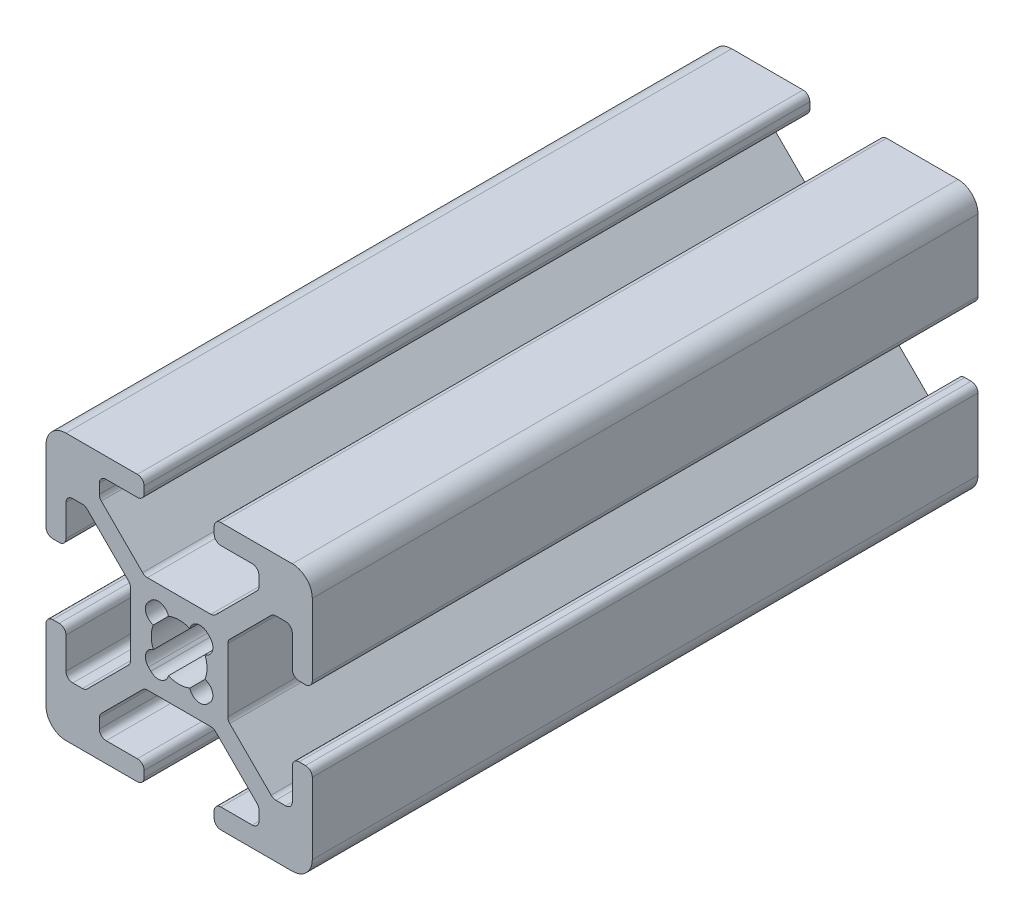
SolidWorks part; units mm, degrees
ref_plane "Front Plane" through (0, 0, 0) normal (0, 0, 1) x (1, 0, 0)
ref_plane "Top Plane" through (0, 0, 0) normal (0, 1, 0) x (1, 0, 0)
ref_plane "Right Plane" through (0, 0, 0) normal (1, 0, 0) x (0, 0, -1)
sketch "Sketch1" plane through (0, 0, 0) normal (0, 0, 1) x (1, 0, 0)
  line L0 (-5.0323, -0.3411) -> (-5.5163, -0.3411)
  line L1 (-6.0243, 0.1669) -> (-6.0243, 2.5159)
  line L2 (-4.5243, 0.1669) -> (-4.5243, 5.5289)
  line L3 (-10.8693, -5.355) -> (-10.8693, -0.5871)
  line L4 (-7.2582, 3.0239) -> (-6.5323, 3.0239)
  line L5 (-7.6174, 2.8752) -> (-10.7205, -0.2279)
  line L6 (-5.0323, -5.6011) -> (-5.5163, -5.6011)
  line L7 (-4.5243, -6.1091) -> (-4.5243, -11.4711)
  line L8 (-6.0243, -6.1091) -> (-6.0243, -8.4581)
  line L9 (-7.2582, -8.9661) -> (-6.5323, -8.9661)
  line L10 (-7.6174, -8.8173) -> (-10.7205, -5.7142)
  line L11 (-12.3994, -5.2756) -> (-12.2198, -5.096)
  line L12 (-17.1543, 6.5209) -> (-17.1543, 6.0369)
  line L13 (-17.6623, 7.0289) -> (-23.0243, 7.0289)
  line L14 (-17.6623, 5.5289) -> (-20.0113, 5.5289)
  line L15 (-12.1404, 0.6839) -> (-16.9082, 0.6839)
  line L16 (-20.5193, 4.295) -> (-20.5193, 5.0209)
  line L17 (-20.3705, 3.9358) -> (-17.2674, 0.8327)
  line L18 (-11.8943, 6.5209) -> (-11.8943, 6.0369)
  line L19 (-11.3863, 7.0289) -> (-6.0243, 7.0289)
  line L20 (-11.3863, 5.5289) -> (-9.0373, 5.5289)
  line L21 (-8.5293, 4.295) -> (-8.5293, 5.0209)
  line L22 (-8.6781, 3.9358) -> (-11.7812, 0.8327)
  line L23 (-12.2198, -0.8462) -> (-12.3994, -0.6666)
  line L24 (-24.0163, -5.6011) -> (-23.5323, -5.6011)
  line L25 (-24.5243, -6.1091) -> (-24.5243, -11.4711)
  line L26 (-23.0243, -6.1091) -> (-23.0243, -8.4581)
  line L27 (-18.1793, -0.5871) -> (-18.1793, -5.355)
  line L28 (-21.7904, -8.9661) -> (-22.5163, -8.9661)
  line L29 (-21.4312, -8.8173) -> (-18.3281, -5.7142)
  line L30 (-24.0163, -0.3411) -> (-23.5323, -0.3411)
  line L31 (-24.5243, 0.1669) -> (-24.5243, 5.5289)
  line L32 (-23.0243, 0.1669) -> (-23.0243, 2.5159)
  line L33 (-21.7904, 3.0239) -> (-22.5163, 3.0239)
  line L34 (-21.4312, 2.8752) -> (-18.3281, -0.2279)
  line L35 (-16.6492, -0.6666) -> (-16.8288, -0.8462)
  line L36 (-11.8943, -12.4631) -> (-11.8943, -11.9791)
  line L37 (-11.3863, -12.9711) -> (-6.0243, -12.9711)
  line L38 (-11.3863, -11.4711) -> (-9.0373, -11.4711)
  line L39 (-16.9082, -6.6261) -> (-12.1404, -6.6261)
  line L40 (-8.5293, -10.2371) -> (-8.5293, -10.9631)
  line L41 (-8.6781, -9.8779) -> (-11.7812, -6.7748)
  line L42 (-17.1543, -12.4631) -> (-17.1543, -11.9791)
  line L43 (-17.6623, -12.9711) -> (-23.0243, -12.9711)
  line L44 (-17.6623, -11.4711) -> (-20.0113, -11.4711)
  line L45 (-20.5193, -10.2371) -> (-20.5193, -10.9631)
  line L46 (-20.3705, -9.8779) -> (-17.2674, -6.7748)
  line L47 (-16.8288, -5.096) -> (-16.6492, -5.2756)
  arc A0 (-15.3283, -4.9062) -> (-13.7203, -4.9062) centre (-14.5243, -2.9711) ccw
  arc A1 (-6.0243, 2.5159) -> (-6.5323, 3.0239) centre (-6.5323, 2.5159) ccw
  arc A2 (-7.2582, 3.0239) -> (-7.6174, 2.8752) centre (-7.2582, 2.5159) ccw
  arc A3 (-10.7205, -0.2279) -> (-10.8693, -0.5871) centre (-10.3613, -0.5871) ccw
  arc A4 (-10.8693, -5.355) -> (-10.7205, -5.7142) centre (-10.3613, -5.355) ccw
  arc A5 (-7.6174, -8.8173) -> (-7.2582, -8.9661) centre (-7.2582, -8.4581) ccw
  arc A6 (-6.5323, -8.9661) -> (-6.0243, -8.4581) centre (-6.5323, -8.4581) ccw
  arc A7 (-5.5163, -5.6011) -> (-6.0243, -6.1091) centre (-5.5163, -6.1091) ccw
  arc A8 (-4.5243, -6.1091) -> (-5.0323, -5.6011) centre (-5.0323, -6.1091) ccw
  arc A9 (-5.0323, -0.3411) -> (-4.5243, 0.1669) centre (-5.0323, 0.1669) ccw
  arc A10 (-6.0243, 0.1669) -> (-5.5163, -0.3411) centre (-5.5163, 0.1669) ccw
  arc A11 (-13.7203, -4.9062) -> (-12.3994, -5.2756) centre (-12.9559, -4.7191) ccw
  arc A12 (-12.2198, -5.096) -> (-12.5892, -3.775) centre (-12.7763, -4.5395) ccw
  arc A13 (-17.1543, 6.5209) -> (-17.6623, 7.0289) centre (-17.6623, 6.5209) ccw
  arc A14 (-17.6623, 5.5289) -> (-17.1543, 6.0369) centre (-17.6623, 6.0369) ccw
  arc A15 (-12.5892, -3.775) -> (-12.5892, -2.1671) centre (-14.5243, -2.9711) ccw
  arc A16 (-17.2674, 0.8327) -> (-16.9082, 0.6839) centre (-16.9082, 1.1919) ccw
  arc A17 (-20.0113, 5.5289) -> (-20.5193, 5.0209) centre (-20.0113, 5.0209) ccw
  arc A18 (-20.5193, 4.295) -> (-20.3705, 3.9358) centre (-20.0113, 4.295) ccw
  arc A19 (-11.8943, 6.0369) -> (-11.3863, 5.5289) centre (-11.3863, 6.0369) ccw
  arc A20 (-11.3863, 7.0289) -> (-11.8943, 6.5209) centre (-11.3863, 6.5209) ccw
  arc A21 (-8.5293, 5.0209) -> (-9.0373, 5.5289) centre (-9.0373, 5.0209) ccw
  arc A22 (-8.6781, 3.9358) -> (-8.5293, 4.295) centre (-9.0373, 4.295) ccw
  arc A23 (-12.1404, 0.6839) -> (-11.7812, 0.8327) centre (-12.1404, 1.1919) ccw
  arc A24 (-12.5892, -2.1671) -> (-12.2198, -0.8462) centre (-12.7763, -1.4027) ccw
  arc A25 (-12.3994, -0.6666) -> (-13.7203, -1.0359) centre (-12.9559, -1.223) ccw
  arc A26 (-24.0163, -5.6011) -> (-24.5243, -6.1091) centre (-24.0163, -6.1091) ccw
  arc A27 (-23.0243, -6.1091) -> (-23.5323, -5.6011) centre (-23.5323, -6.1091) ccw
  arc A28 (-13.7203, -1.0359) -> (-15.3283, -1.0359) centre (-14.5243, -2.9711) ccw
  arc A29 (-18.3281, -5.7142) -> (-18.1793, -5.355) centre (-18.6873, -5.355) ccw
  arc A30 (-23.0243, -8.4581) -> (-22.5163, -8.9661) centre (-22.5163, -8.4581) ccw
  arc A31 (-21.7904, -8.9661) -> (-21.4312, -8.8173) centre (-21.7904, -8.4581) ccw
  arc A32 (-23.5323, -0.3411) -> (-23.0243, 0.1669) centre (-23.5323, 0.1669) ccw
  arc A33 (-24.5243, 0.1669) -> (-24.0163, -0.3411) centre (-24.0163, 0.1669) ccw
  arc A34 (-22.5163, 3.0239) -> (-23.0243, 2.5159) centre (-22.5163, 2.5159) ccw
  arc A35 (-21.4312, 2.8752) -> (-21.7904, 3.0239) centre (-21.7904, 2.5159) ccw
  arc A36 (-18.1793, -0.5871) -> (-18.3281, -0.2279) centre (-18.6873, -0.5871) ccw
  arc A37 (-15.3283, -1.0359) -> (-16.6492, -0.6666) centre (-16.0927, -1.223) ccw
  arc A38 (-16.8288, -0.8462) -> (-16.4594, -2.1671) centre (-16.2723, -1.4027) ccw
  arc A39 (-11.8943, -12.4631) -> (-11.3863, -12.9711) centre (-11.3863, -12.4631) ccw
  arc A40 (-11.3863, -11.4711) -> (-11.8943, -11.9791) centre (-11.3863, -11.9791) ccw
  arc A41 (-16.4594, -2.1671) -> (-16.4594, -3.775) centre (-14.5243, -2.9711) ccw
  arc A42 (-11.7812, -6.7748) -> (-12.1404, -6.6261) centre (-12.1404, -7.1341) ccw
  arc A43 (-9.0373, -11.4711) -> (-8.5293, -10.9631) centre (-9.0373, -10.9631) ccw
  arc A44 (-8.5293, -10.2371) -> (-8.6781, -9.8779) centre (-9.0373, -10.2371) ccw
  arc A45 (-17.1543, -11.9791) -> (-17.6623, -11.4711) centre (-17.6623, -11.9791) ccw
  arc A46 (-17.6623, -12.9711) -> (-17.1543, -12.4631) centre (-17.6623, -12.4631) ccw
  arc A47 (-20.5193, -10.9631) -> (-20.0113, -11.4711) centre (-20.0113, -10.9631) ccw
  arc A48 (-20.3705, -9.8779) -> (-20.5193, -10.2371) centre (-20.0113, -10.2371) ccw
  arc A49 (-16.9082, -6.6261) -> (-17.2674, -6.7748) centre (-16.9082, -7.1341) ccw
  arc A50 (-16.4594, -3.775) -> (-16.8288, -5.096) centre (-16.2723, -4.5395) ccw
  arc A51 (-16.6492, -5.2756) -> (-15.3283, -4.9062) centre (-16.0927, -4.7191) ccw
  arc A52 (-4.5243, 5.5289) -> (-6.0243, 7.0289) centre (-6.0243, 5.5289) ccw
  arc A53 (-6.0243, -12.9711) -> (-4.5243, -11.4711) centre (-6.0243, -11.4711) ccw
  arc A54 (-24.5243, -11.4711) -> (-23.0243, -12.9711) centre (-23.0243, -11.4711) ccw
  arc A55 (-23.0243, 7.0289) -> (-24.5243, 5.5289) centre (-23.0243, 5.5289) ccw
extrude "Boss-Extrude1" add sketch "Sketch1" along normal blind 50
